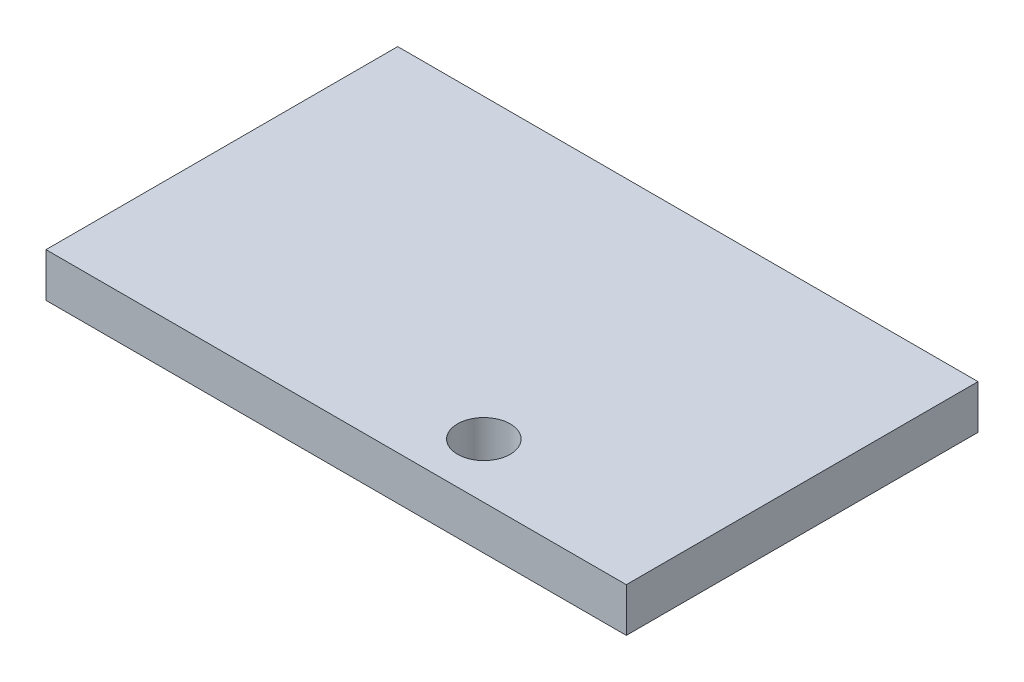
SolidWorks part; units mm, degrees
ref_plane "Front Plane" through (0, 0, 0) normal (0, 0, 1) x (1, 0, 0)
ref_plane "Top Plane" through (0, 0, 0) normal (0, 1, 0) x (1, 0, 0)
ref_plane "Right Plane" through (0, 0, 0) normal (1, 0, 0) x (0, 0, -1)
sketch "Sketch1" plane through (0, 0, 0) normal (0, 1, 0) x (1, 0, 0)
  line L1 (-17.0071, 9.2837) -> (15.9929, 9.2837)
  line L2 (-17.0071, 9.2837) -> (-17.0071, -10.7163)
  line L3 (-17.0071, -10.7163) -> (15.9929, -10.7163)
  line L4 (15.9929, 9.2837) -> (15.9929, -10.7163)
  dimension "D1" = 33
  dimension "D2" = 20
extrude "Boss-Extrude1" add sketch "Sketch1" along normal blind 2.5
sketch "Sketch2" plane through (0, 2.5, 0) normal (0, 1, 0) x (1, 0, 0)
  circle A0 centre (4.7728, -7.5967) radius 1.5
  point P2 (4.7728, -7.5967)
extrude "Cut-Extrude1" cut sketch "Sketch2" against normal blind 2.5
